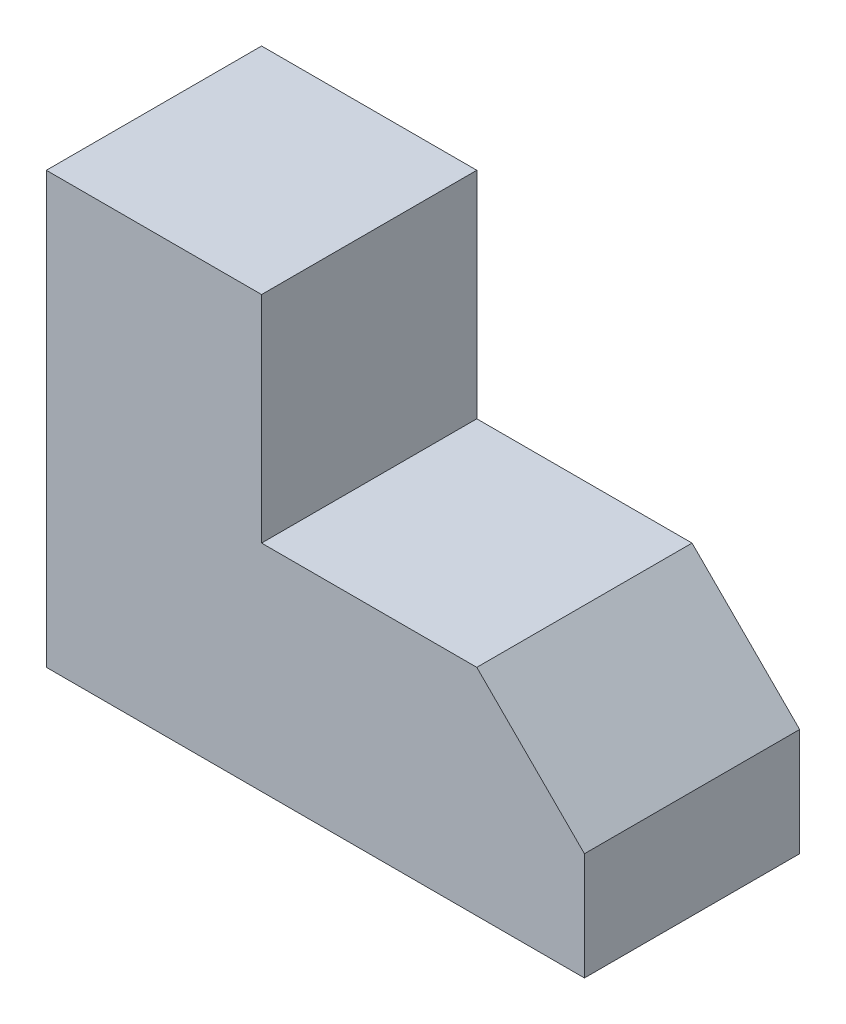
SolidWorks part; units mm, degrees
ref_plane "Plan de face" through (0, 0, 0) normal (0, 0, 1) x (1, 0, 0)
ref_plane "Plan de dessus" through (0, 0, 0) normal (0, 1, 0) x (1, 0, 0)
ref_plane "Plan de droite" through (0, 0, 0) normal (1, 0, 0) x (0, 0, -1)
sketch "Esquisse1" plane through (0, 0, 0) normal (0, 0, 1) x (1, 0, 0)
  line L0 (0, 0) -> (0, 20)
  line L1 (0, 20) -> (10, 20)
  line L2 (10, 20) -> (10, 10)
  line L3 (10, 10) -> (25, 10)
  line L4 (25, 10) -> (25, 0)
  line L5 (25, 0) -> (0, 0)
  dimension "D1" = 10
  dimension "D2" = 20
  dimension "D3" = 10
  dimension "D4" = 25
extrude "Boss.-Extru.1" add sketch "Esquisse1" along normal blind 10
chamfer "Chanfrein1" distance 5 angle 45 1 edges at (25, 10, 5)
